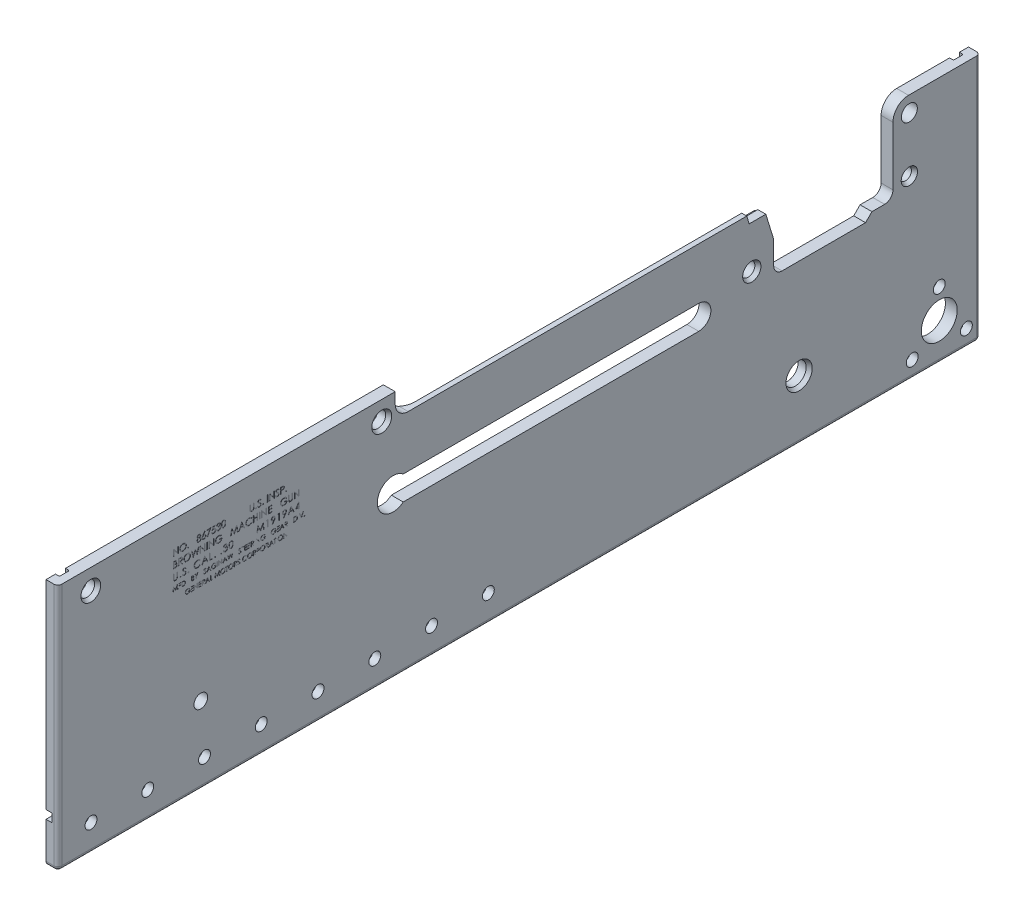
SolidWorks part; units mm, degrees
ref_plane "Front Plane" through (0, 0, 0) normal (0, 0, 1) x (1, 0, 0)
ref_plane "Top Plane" through (0, 0, 0) normal (0, 1, 0) x (1, 0, 0)
ref_plane "Right Plane" through (0, 0, 0) normal (1, 0, 0) x (0, 0, -1)
sketch "Sketch1" plane through (0, 0, 0) normal (1, 0, 0) x (0, 0, -1)
  line L1 (0, 0) -> (-367.6396, 0)
  line L2 (0, 0) -> (0, 98.7806)
  line L3 (0, 98.7806) -> (-367.6396, 98.7806)
  line L4 (-367.6396, 0) -> (-367.6396, 98.7806)
  dimension "D1" = 98.7806
  dimension "D2" = 367.6396
extrude "Boss-Extrude1" add sketch "Sketch1" against normal blind 4.7244
sketch "Sketch2" plane through (0, 0, 0) normal (1, 0, 0) x (0, 0, -1)
  line L0 (-388.3824, 23.7998) -> (18.2086, 23.7998) construction
  line L1 (-367.6396, 0) -> (0, 0) construction
  line L2 (0, 0) -> (0, 98.7806) construction
  line L3 (0, 98.7806) -> (-367.6396, 98.7806) construction
  circle A0 centre (-16.3576, 14.9098) radius 7.1501
  circle A1 centre (-72.2376, 23.7998) radius 4.3523
  circle A2 centre (-28.2956, 92.583) radius 3.175
  circle A3 centre (-16.3576, 26.5684) radius 2.3686
  circle A4 centre (-27.1526, 6.7818) radius 2.3686
  circle A5 centre (-5.5626, 6.7818) radius 2.3685
  circle A6 centre (-91.0844, 69.1896) radius 2.7648
  circle A7 centre (-28.2956, 70.6882) radius 2.3685
  circle A8 centre (-354.5078, 90.7288) radius 3.052
  circle A9 centre (-238.5568, 91.1098) radius 3.1036
  point P30 (-163.6939, 133.7197)
  dimension "D1" = 14.3002
  dimension "D5" = 8.7046
  dimension "D8" = 6.1976
  dimension "D9" = 6.35
  dimension "D11" = 4.7371
  dimension "D14" = 4.7371
  dimension "D16" = 4.7371
  dimension "D19" = 5.5296
  dimension "D21" = 4.7371
  dimension "D2" = 23.7998
  dimension "D3" = 8.89
  dimension "D4" = 72.2376
  dimension "D6" = 55.88
  dimension "D7" = 43.942
  dimension "D10" = 2.7686
  dimension "D12" = 45.085
  dimension "D13" = 17.018
  dimension "D15" = 66.675
  dimension "D17" = 45.3898
  dimension "D18" = 18.8468
  dimension "D20" = 46.8884
  dimension "D22" = 43.942
  dimension "D23" = 66.929
  dimension "D24" = 115.951
  dimension "D25" = 166.3192
  dimension "D26" = 67.31
sketch "Sketch3" plane through (0, 0, 0) normal (1, 0, 0) x (0, 0, -1)
  line L0 (0, 98.7806) -> (-367.6396, 98.7806) construction
  line L1 (-34.8234, 98.7806) -> (-233.1974, 98.7806)
  line L2 (-34.8234, 98.7806) -> (-34.8234, 69.2404)
  line L3 (-228.0412, 89.3318) -> (-93.0872, 89.3318)
  line L4 (-233.1974, 98.7806) -> (-233.1974, 94.488)
  line L5 (0, 0) -> (0, 98.7806) construction
  line L6 (-82.3468, 75.9206) -> (-85.4763, 86.1568)
  line L8 (-388.3824, 23.7998) -> (18.2086, 23.7998) construction
  line L9 (-38.1508, 65.913) -> (-43.2054, 65.913)
  line L10 (-43.2054, 65.913) -> (-45.7454, 63.373)
  line L11 (-45.7454, 63.373) -> (-79.0194, 63.373)
  line L13 (-82.3468, 75.9206) -> (-82.3468, 66.7004)
  line L16 (-92.1165, 86.1568) -> (-93.0872, 89.3318)
  line L17 (-92.1165, 86.1568) -> (-85.4763, 86.1568)
  arc A0 (-34.8234, 69.2404) -> (-38.1508, 65.913) centre (-38.1508, 69.2404) cw
  arc A1 (-82.3468, 66.7004) -> (-79.0194, 63.373) centre (-79.0194, 66.7004) ccw
  arc A2 (-228.0412, 89.3318) -> (-233.1974, 94.488) centre (-228.0412, 94.488) cw
  point P17 (-34.8234, 65.913)
  point P20 (-82.3468, 63.373)
  point P23 (-160.9598, 89.3318)
  point P24 (-82.3468, 75.9206)
  dimension "D9" = 3.3274
  dimension "D10" = 5.1562
  dimension "D2" = 9.4488
  dimension "D3" = 37.4142
  dimension "D4" = 160.9598
  dimension "D5" = 39.5732
  dimension "D6" = 42.1132
  dimension "D7" = 45
  dimension "D8" = 26.4922
  dimension "D11" = 52.1208
  dimension "D12" = 17
  dimension "D13" = 6.35
  dimension "D14" = 82.3468
extrude "Cut-Extrude1" cut sketch "Sketch3" against normal blind 4.7244
fillet "Fillet1" radius 6.1976 1 edges at (-2.3622, 98.7806, 34.8234)
sketch "Sketch4" plane through (0, 0, 0) normal (1, 0, 0) x (0, 0, -1)
  line L0 (-388.3824, 23.7998) -> (18.2086, 23.7998) construction
  line L1 (-230.007, 59.1058) -> (-112.2172, 59.1058)
  line L3 (-112.2172, 68.7578) -> (-230.007, 68.7578)
  arc A0 (-112.2172, 59.1058) -> (-107.3912, 63.9318) centre (-112.2172, 63.9318) ccw
  arc A1 (-107.3912, 63.9318) -> (-112.2172, 68.7578) centre (-112.2172, 63.9318) ccw
  arc A2 (-230.007, 68.7578) -> (-230.007, 59.1058) centre (-234.0356, 63.9318) ccw
  circle A3 centre (-234.0356, 63.9318) radius 6.2865 construction
  point P4 (-234.0356, 63.9318)
  dimension "D5" = 4.826
  dimension "D2" = 12.573
  dimension "D1" = 39.9796
  dimension "D3" = 40.132
  dimension "D4" = 161.798
  dimension "D6" = 9.652
extrude "Cut-Extrude2" cut sketch "Sketch4" against normal blind 4.7244
sketch "Sketch5" plane through (0, 98.7806, 0) normal (0, 1, 0) x (1, 0, 0)
  line L0 (-4.7244, 0) -> (-4.7244, -28.6258) construction
  line L1 (-4.7244, -3.6322) -> (-3.1496, -3.6322)
  line L2 (-4.7244, -3.6322) -> (-4.7244, -7.5692)
  line L3 (-4.7244, -7.5692) -> (-3.1496, -7.5692)
  line L4 (-3.1496, -3.6322) -> (-3.1496, -7.5692)
  line L6 (-16.7111, -72.2376) -> (14.7935, -72.2376) construction
  line L7 (-4.7244, 0) -> (0, 0) construction
  line L8 (-4.7244, -233.1974) -> (-4.7244, -367.6396) construction
  line L9 (-4.7244, -363.855) -> (-3.1496, -363.855)
  line L10 (-4.7244, -363.855) -> (-4.7244, -359.8672)
  line L11 (-4.7244, -359.8672) -> (-3.1496, -359.8672)
  line L12 (-3.1496, -363.855) -> (-3.1496, -359.8672)
  dimension "D1" = 1.5748
  dimension "D2" = 3.937
  dimension "D3" = 72.2376
  dimension "D4" = 68.6054
  dimension "D5" = 3.9878
  dimension "D6" = 1.5748
  dimension "D7" = 291.6174
extrude "Cut-Extrude3" cut sketch "Sketch5" against normal blind 106.5784
fillet "Fillet2" radius 0.508 4 edges at (-3.1496, 49.3903, 363.855) (-3.1496, 49.3903, 359.8672) (-3.1496, 49.3903, 3.6322) (-3.1496, 49.3903, 7.5692)
sketch "Sketch6" plane through (-4.7244, 0, 0) normal (-1, 0, 0) x (0, 0, 1)
  line L0 (359.8672, 0) -> (7.5692, 0) construction
  line L1 (228.8376, 96.4184) -> (359.7656, 96.4184)
  line L2 (228.8376, 96.4184) -> (228.8376, 93.853)
  line L3 (228.8376, 93.853) -> (359.7656, 93.853)
  line L4 (359.7656, 96.4184) -> (359.7656, 93.853)
  dimension "D1" = 287.528
  dimension "D2" = 2.5654
  dimension "D3" = 96.4184
extrude "Cut-Extrude4" cut sketch "Sketch6" against normal blind 2.3622
sketch "Sketch7" plane through (0, 93.853, 0) normal (0, 1, 0) x (1, 0, 0)
  circle A0 centre (-13.335, -359.7656) radius 10.9728
extrude "Cut-Extrude5" cut sketch "Sketch7" along normal up to surface (2.5654 mm away)
sketch "Sketch8" plane through (-4.7244, 0, 0) normal (-1, 0, 0) x (0, 0, 1)
  line L0 (314.3313, 19.4056) -> (367.6396, 19.4056)
  line L1 (367.6396, 98.7806) -> (367.6396, 0) construction
  line L2 (314.3313, 19.4056) -> (314.3313, 16.0528)
  line L3 (367.6396, 19.4056) -> (367.6396, 16.0528)
  line L4 (367.6396, 16.0528) -> (314.3313, 16.0528)
  line L5 (388.3824, 23.7998) -> (-18.2086, 23.7998) construction
  dimension "D1" = 242.0938
  dimension "D2" = 3.3528
  dimension "D3" = 4.3942
extrude "Cut-Extrude6" cut sketch "Sketch8" against normal blind 2.3876
sketch "Sketch9" plane through (0, 16.0528, 0) normal (0, 1, 0) x (1, 0, 0)
  circle A0 centre (-13.3096, -314.3313) radius 10.9728
extrude "Cut-Extrude7" cut sketch "Sketch9" along normal up to surface (3.3528 mm away)
sketch "Sketch10" plane through (0, 89.3318, 0) normal (0, 1, 0) x (1, 0, 0)
  line L1 (-4.7244, -228.0412) -> (-4.7244, -93.0872) construction
  line L2 (-3.2004, -223.3676) -> (-3.2004, -75.2641)
  line L3 (0, -76.5899) -> (0, -67.8853) construction
  line L4 (0, -72.2376) -> (-20.0284, -72.2376) construction
  line L5 (-3.2004, -75.2641) -> (-15.9004, -75.2641)
  line L6 (-15.9004, -223.3676) -> (-15.9004, -75.2641)
  arc A1 (-3.2004, -223.3676) -> (-15.9004, -223.3676) centre (-9.5504, -223.3676) cw
  point P2 (-3.2004, -223.3676)
  dimension "D1" = 6.35
  dimension "D2" = 1.524
extrude "Cut-Extrude8" cut sketch "Sketch10" against normal blind 4.318
chamfer "Chamfer1" distance 1.1906 angle 45 2 edges at (-3.5936, 89.3318, 225.5673) (-3.2004, 89.3318, 158.2274)
sketch "Sketch11" plane through (0, 0, 0) normal (1, 0, 0) x (0, 0, -1)
  line L1 (-388.3824, 23.7998) -> (18.2086, 23.7998) construction
  circle A0 centre (-310.6674, 30.7594) radius 2.7305
  dimension "D1" = 5.461
  dimension "D2" = 6.9596
  dimension "D3" = 238.4298
extrude "Cut-Extrude9" cut sketch "Sketch11" against normal blind 11.684
extrude "DRILL AT ASSEMBLY" cut sketch "Sketch2" against normal blind 11.684
fillet "Fillet3" radius 1.5875 5 edges at (0, 49.3903, 0) (0, 49.3903, 367.6396) (-2.3622, 0, 0) (0, 0, 183.8198) (-2.3622, 0, 367.6396)
sketch "Sketch12" plane through (0, 0, 0) normal (1, 0, 0) x (0, 0, -1)
  line L0 (-366.0521, 0) -> (-1.5875, 0) construction
  line L2 (-363.855, 16.0528) -> (-363.855, 0) construction
  circle A0 centre (-354.4316, 10.6934) radius 2.3749
  circle A1 centre (-331.8111, 10.6934) radius 2.3749
  circle A2 centre (-309.1906, 10.6934) radius 2.3749
  circle A3 centre (-286.5701, 10.6934) radius 2.3749
  circle A4 centre (-263.9495, 10.6934) radius 2.3749
  circle A5 centre (-241.329, 10.6934) radius 2.3749
  circle A6 centre (-218.7085, 10.6934) radius 2.3749
  circle A7 centre (-196.088, 10.6934) radius 2.3749
  dimension "D3" = 4.7498
  dimension "D4" = 8
  dimension "D1" = 10.6934
  dimension "D2" = 9.4234
  dimension "D5" = 158.3436
extrude "DRILL AT ASSEMBLY (2)" cut sketch "Sketch12" against normal blind 11.684
chamfer "Chamfer2" distance 1.5748 angle 30 8 edges at (-4.7244, 10.6934, 193.7131) (-4.7244, 10.6934, 216.3336) (-4.7244, 10.6934, 238.9541) (-4.7244, 10.6934, 261.5746) (-4.7244, 10.6934, 284.1952) (-4.7244, 10.6934, 329.4362) (-4.7244, 10.6934, 352.0567) (-4.7244, 10.6934, 306.8157)
sketch "Sketch13" plane through (0, 0, 0) normal (1, 0, 0) x (0, 0, -1)
  line L0 (-233.1974, 98.7806) -> (-366.0521, 98.7806) construction
  line L3 (-321.9196, 86.0806) -> (-296.5196, 86.0806) construction
  line L4 (-321.9196, 73.8886) -> (-271.1196, 73.8886) construction
  line L5 (-321.9196, 81.7626) -> (-271.1196, 81.7626) construction
  line L6 (-321.9196, 77.4446) -> (-271.1196, 77.4446) construction
  line L7 (-321.9196, 70.3326) -> (-271.1196, 70.3326) construction
  point P8 (-367.6396, 98.7806)
  dimension "D1" = 12.7
  dimension "D2" = 4.318
  dimension "D3" = 3.556
  dimension "D4" = 3.556
  dimension "D6" = 4.318
sketch "Sketch14" plane through (0, 0, 0) normal (1, 0, 0) x (0, 0, -1)
  text T0 "NO.   867530" font "Century Gothic" height 2.54
sketch "Sketch15" plane through (0, 0, 0) normal (1, 0, 0) x (0, 0, -1)
  line L0 (-291.4396, 86.0806) -> (-273.0597, 86.0806) construction
  dimension "D1" = 30.48
sketch "Sketch16" plane through (0, 0, 0) normal (1, 0, 0) x (0, 0, -1)
  text T0 "U.S. INSP." font "Century Gothic" height 2.54
sketch "Sketch17" plane through (0, 0, 0) normal (1, 0, 0) x (0, 0, -1)
  line L0 (-321.9196, 81.7626) -> (-271.1196, 81.7626) construction
sketch "Sketch18" plane through (0, 0, 0) normal (1, 0, 0) x (0, 0, -1)
  text T0 "BROWNING   MACHINE   GUN" font "Century Gothic" height 2.54
sketch "Sketch19" plane through (0, 0, 0) normal (1, 0, 0) x (0, 0, -1)
  line L0 (-321.9196, 77.4446) -> (-271.1196, 77.4446) construction
sketch "Sketch20" plane through (0, 0, 0) normal (1, 0, 0) x (0, 0, -1)
  text T0 "U.S. CAL. .30       M1919A4" font "Century Gothic" height 2.54
sketch "Sketch21" plane through (0, 0, 0) normal (1, 0, 0) x (0, 0, -1)
  line L0 (-321.9196, 73.8886) -> (-258.4196, 73.8886) construction
  line L1 (-367.6396, 1.5875) -> (-367.6396, 98.7806) construction
  dimension "D1" = 45.72
  dimension "D2" = 63.5
sketch "Sketch22" plane through (0, 0, 0) normal (1, 0, 0) x (0, 0, -1)
  text T0 "MFD   BY   SAGINAW   STEERING   GEAR   DIV." font "Century Gothic" height 1.778
sketch "Sketch23" plane through (0, 0, 0) normal (1, 0, 0) x (0, 0, -1)
  line L0 (-321.9196, 70.3326) -> (-271.1196, 70.3326) construction
sketch "Sketch24" plane through (0, 0, 0) normal (1, 0, 0) x (0, 0, -1)
  text T0 "GENERAL MOTORS CORPORATION" font "Century Gothic" height 1.778
extrude "Cut-Extrude12" cut sketch "Sketch14" against normal blind 0.0762
extrude "Cut-Extrude13" cut sketch "Sketch16" against normal blind 0.0762
extrude "Cut-Extrude14" cut sketch "Sketch18" against normal blind 0.0762
extrude "Cut-Extrude15" cut sketch "Sketch20" against normal blind 0.0762
extrude "Cut-Extrude16" cut sketch "Sketch22" against normal blind 0.0762
extrude "Cut-Extrude17" cut sketch "Sketch24" against normal blind 0.0762
chamfer "Chamfer3" distance 1.524 angle 30 5 edges at (0, 90.7288, 351.4558) (0, 91.1098, 235.4532) (0, 69.1896, 88.3196) (0, 70.6882, 25.9271) (0, 23.7998, 67.8853)
chamfer "Chamfer4" distance 1.524 angle 30 2 edges at (-4.7244, 6.7818, 24.7841) (-4.7244, 26.5684, 13.989)
